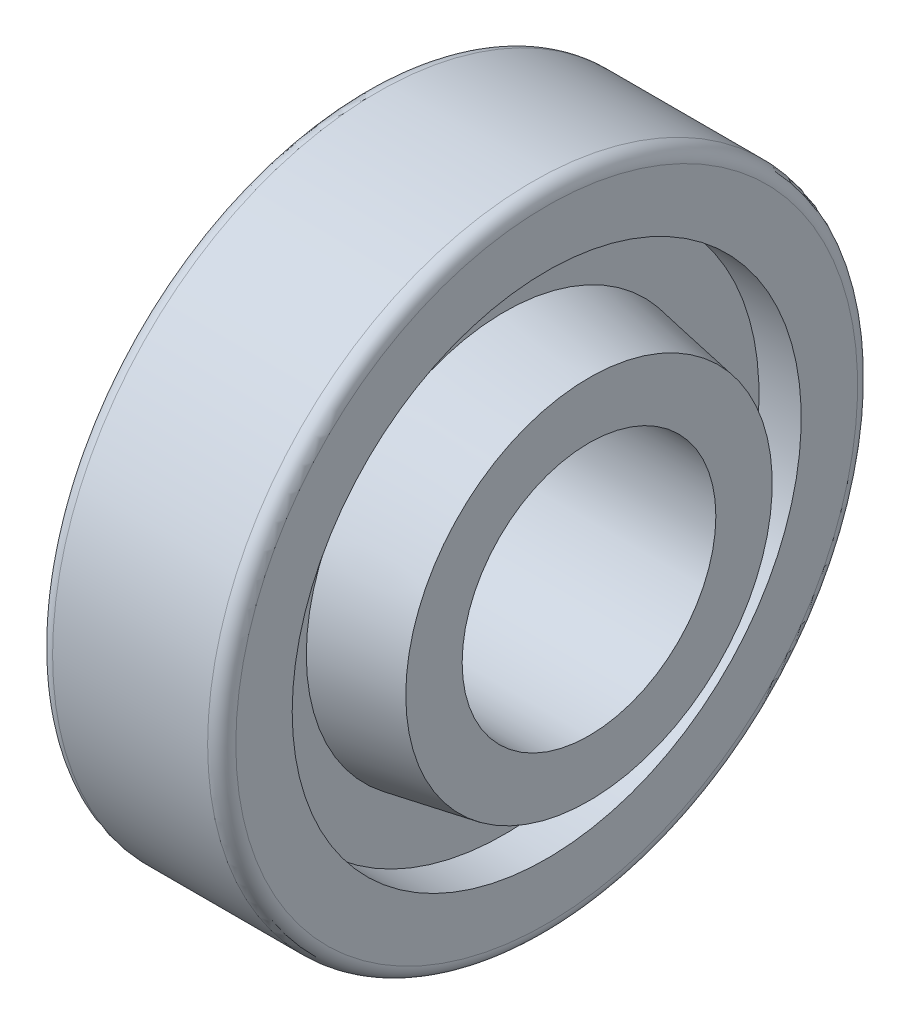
SolidWorks part; units mm, degrees
ref_plane "Plan de face" through (0, 0, 0) normal (0, 0, 1) x (1, 0, 0)
ref_plane "Plan de dessus" through (0, 0, 0) normal (0, 1, 0) x (1, 0, 0)
ref_plane "Plan de droite" through (0, 0, 0) normal (1, 0, 0) x (0, 0, -1)
sketch "Esquisse1" plane through (0, 0, 0) normal (0, 0, 1) x (1, 0, 0)
  line L0 (-65.7699, 0) -> (87.9662, 0) construction
  line L1 (0, 122.6324) -> (0, -72.5644) construction
  line L2 (32.5, 115.2898) -> (-32.5, 115.2898)
  line L3 (-32.5, 115.2898) -> (-32.5, 90.2898)
  line L4 (-32.5, 90.2898) -> (-17.5, 90.2898)
  line L5 (-17.5, 90.2898) -> (-17.5, 70.2898)
  line L6 (-17.5, 70.2898) -> (-47.5, 65)
  line L7 (-47.5, 65) -> (-47.5, 45)
  line L8 (-47.5, 45) -> (47.5, 45)
  line L9 (47.5, 65) -> (47.5, 45)
  line L10 (17.5, 70.2898) -> (47.5, 65)
  line L11 (17.5, 90.2898) -> (17.5, 70.2898)
  line L12 (32.5, 90.2898) -> (17.5, 90.2898)
  line L13 (32.5, 115.2898) -> (32.5, 90.2898)
  point P14 (0, 45)
  point P19 (0, 115.2898)
  dimension "D1" = 65
  dimension "D2" = 95
  dimension "D3" = 35
  dimension "D4" = 100
  dimension "D5" = 25
  dimension "D6" = 20
  dimension "D7" = 20
  dimension "D8" = 45
revolve "Révolution1" add sketch "Esquisse1" angle 360 about L0
fillet "Congé1" radius 5 2 edges at (-32.5, 0, 115.2898) (32.5, 0, 115.2898)
